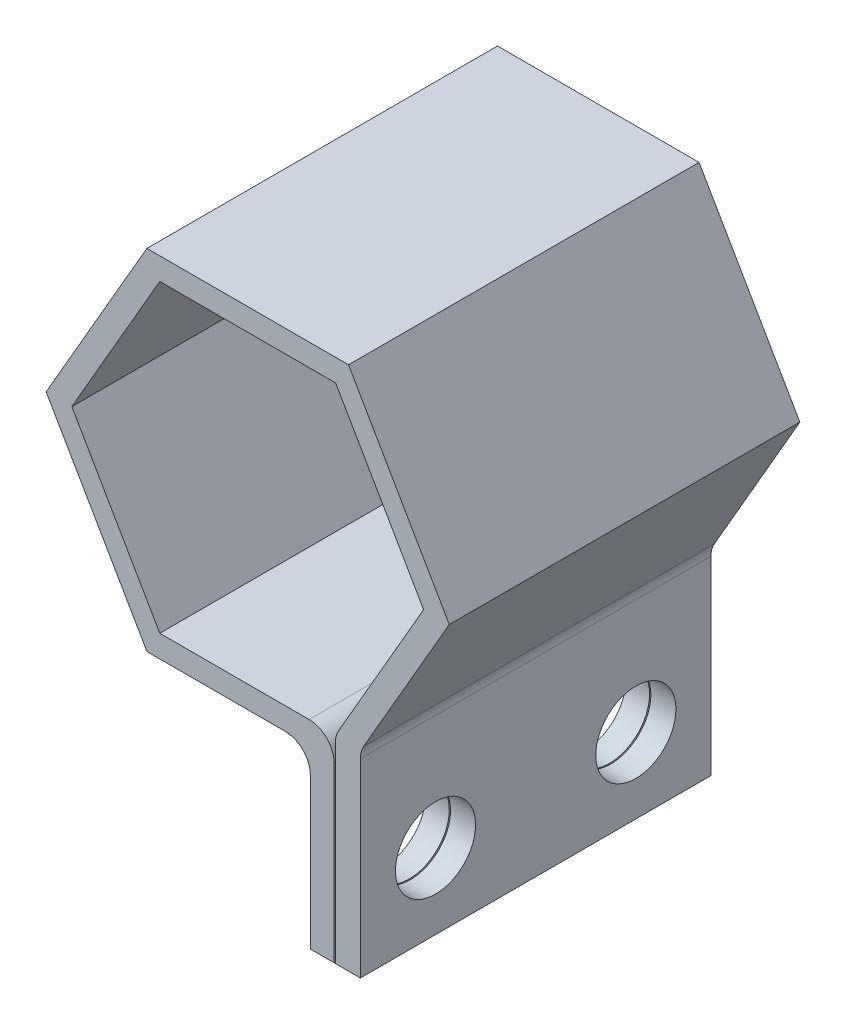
SolidWorks part; units mm, degrees
ref_plane "Front Plane" through (0, 0, 0) normal (0, 0, 1) x (1, 0, 0)
ref_plane "Top Plane" through (0, 0, 0) normal (0, 1, 0) x (1, 0, 0)
ref_plane "Right Plane" through (0, 0, 0) normal (1, 0, 0) x (0, 0, -1)
sketch "Sketch1" plane through (0, 0, 0) normal (0, 0, 1) x (1, 0, 0)
  line L0 (7.025, 0) -> (-7.025, 0) construction
  line L1 (8.05, 0) -> (4.025, 6.9715)
  line L2 (4.025, 6.9715) -> (-4.025, 6.9715)
  line L3 (-4.025, 6.9715) -> (-8.05, 0)
  line L4 (-8.05, 0) -> (-4.025, -6.9715)
  line L5 (-4.025, -6.9715) -> (1.5, -6.9715)
  line L6 (4.634, -5.9167) -> (8.05, 0)
  line L7 (7.025, 0) -> (3.5125, 6.0838)
  line L8 (3.5125, 6.0838) -> (-3.5125, 6.0838)
  line L9 (-3.5125, 6.0838) -> (-7.025, 0)
  line L10 (-7.025, 0) -> (-3.5125, -6.0838)
  line L11 (-3.5125, -6.0838) -> (2.45, -6.0838)
  line L12 (3.634, -5.8734) -> (7.025, 0)
  line L13 (2.5, -7.9715) -> (2.5, -14)
  line L14 (0, 0) -> (0, -9.5581) construction
  line L15 (4.5, -14) -> (3.5, -14)
  line L17 (3.45, -7.0838) -> (3.45, -14)
  line L18 (4.5, -6.4167) -> (4.5, -14)
  line L21 (2.5, 0) -> (2.5, -9.5581) construction
  line L23 (7.025, -14) -> (-7.025, -14) construction
  line L24 (3.5, -6.3734) -> (3.5, -14)
  line L27 (3.45, -14) -> (2.5, -14)
  circle A0 centre (0, 0) radius 6.9715 construction
  circle A1 centre (0, 0) radius 6.0838 construction
  arc A2 (4.634, -5.9167) -> (4.5, -6.4167) centre (5.5, -6.4167) ccw
  arc A3 (3.634, -5.8734) -> (3.5, -6.3734) centre (4.5, -6.3734) ccw
  arc A4 (1.5, -6.9715) -> (2.5, -7.9715) centre (1.5, -7.9715) cw
  arc A5 (3.45, -7.0838) -> (2.45, -6.0838) centre (2.45, -7.0838) ccw
  dimension "D9" = 0.95
  dimension "D7" = 1
  dimension "D1" = 14.05
  dimension "D3" = 2.5
  dimension "D4" = 14
  dimension "D8" = 7.5833
  dimension "D2" = 16.1
  dimension "D5" = 1
  dimension "D6" = 0.05
extrude "Boss-Extrude1" add sketch "Sketch1" along normal blind 14
sketch "Sketch2" plane through (4.5, 0, 0) normal (1, 0, 0) x (0, 0, -1)
  line L0 (-14, -14) -> (-14, -6.4167) construction
  line L2 (-14, -14) -> (0, -14) construction
  circle A0 centre (-11, -11) radius 1.6
  circle A1 centre (-3, -11) radius 1.6
  dimension "D1" = 3.2
  dimension "D2" = 3
  dimension "D3" = 8
  dimension "D4" = 3
extrude "Cut-Extrude1" cut sketch "Sketch2" against normal up to surface (2 mm away)
